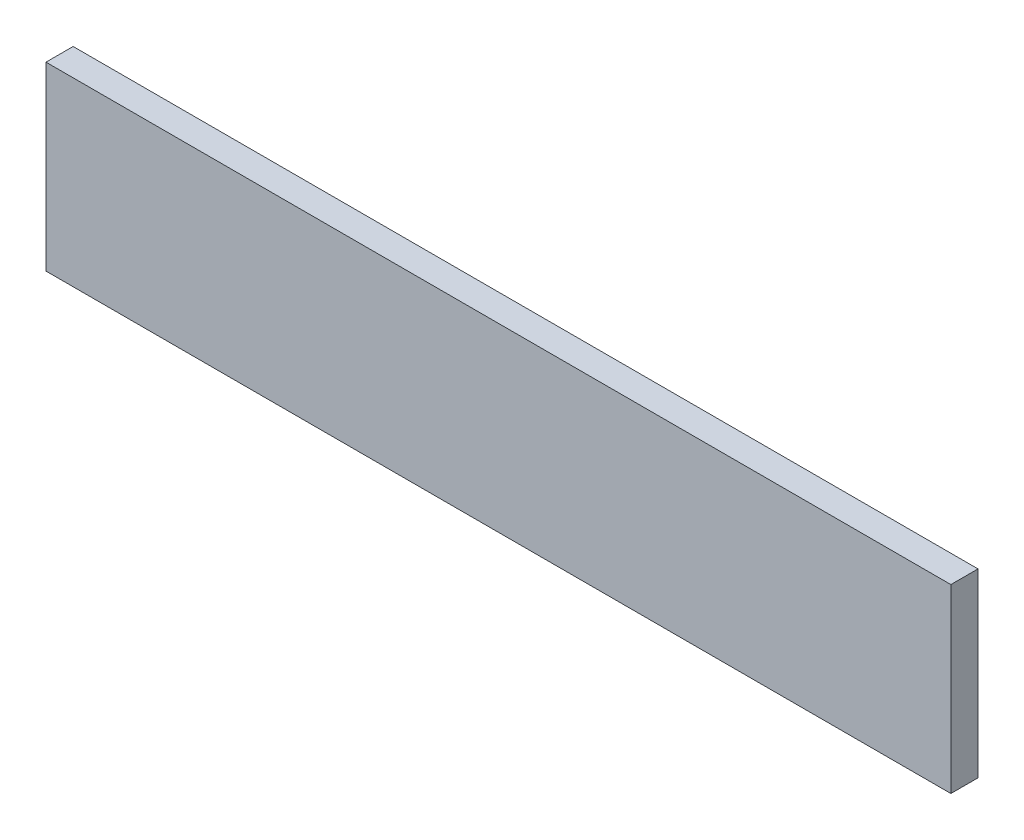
SolidWorks part; units mm, degrees
ref_plane "Plan de face" through (0, 0, 0) normal (0, 0, 1) x (1, 0, 0)
ref_plane "Plan de dessus" through (0, 0, 0) normal (0, 1, 0) x (1, 0, 0)
ref_plane "Plan de droite" through (0, 0, 0) normal (1, 0, 0) x (0, 0, -1)
sketch "Esquisse1" plane through (0, 0, 0) normal (0, 0, 1) x (1, 0, 0)
  line L0 (100, 20) -> (-100, -20) construction
  line L1 (-100, 20) -> (100, 20)
  line L2 (-100, 20) -> (-100, -20)
  line L3 (-100, -20) -> (100, -20)
  line L4 (100, 20) -> (100, -20)
  dimension "D1" = 40
  dimension "D2" = 200
extrude "Boss.-Extru.1" add sketch "Esquisse1" along normal blind 6
